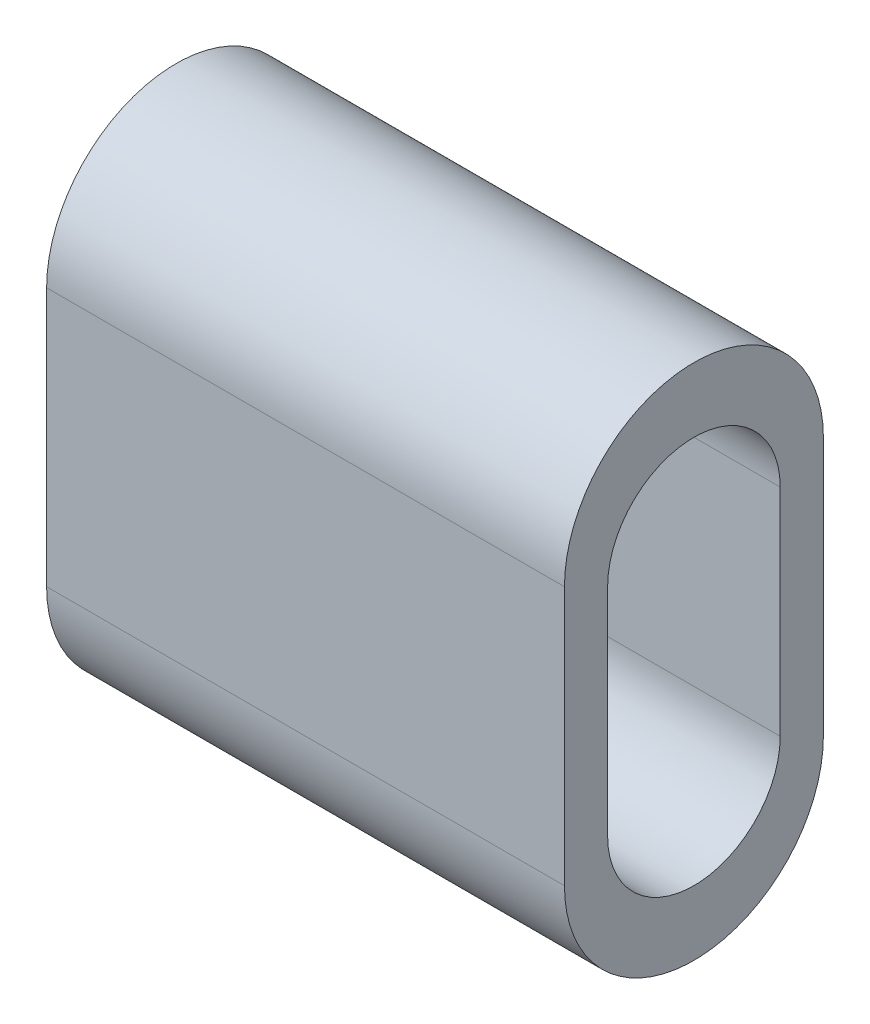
SolidWorks part; units mm, degrees
ref_plane "Plan de face" through (0, 0, 0) normal (0, 0, 1) x (1, 0, 0)
ref_plane "Plan de dessus" through (0, 0, 0) normal (0, 1, 0) x (1, 0, 0)
ref_plane "Plan de droite" through (0, 0, 0) normal (1, 0, 0) x (0, 0, -1)
ref_plane "Plan1" through (12, 0, 0) normal (1, 0, 0) x (0, 0, -1)
sketch "Esquisse1" plane through (12, 0, 0) normal (1, 0, 0) x (0, 0, -1)
  line L0 (2, 2.5) -> (2, -2.5)
  line L1 (-2, -2.5) -> (-2, 2.5)
  line L2 (3, -3) -> (3, 3)
  line L3 (-3, 3) -> (-3, -3)
  arc A0 (2, -2.5) -> (-2, -2.5) centre (0, -2.5) cw
  arc A1 (-2, 2.5) -> (2, 2.5) centre (0, 2.5) cw
  arc A2 (3, 3) -> (-3, 3) centre (0, 3) ccw
  arc A3 (-3, -3) -> (3, -3) centre (0, -3) ccw
extrude "Boss.-Extru.1" add sketch "Esquisse1" against normal blind 12
